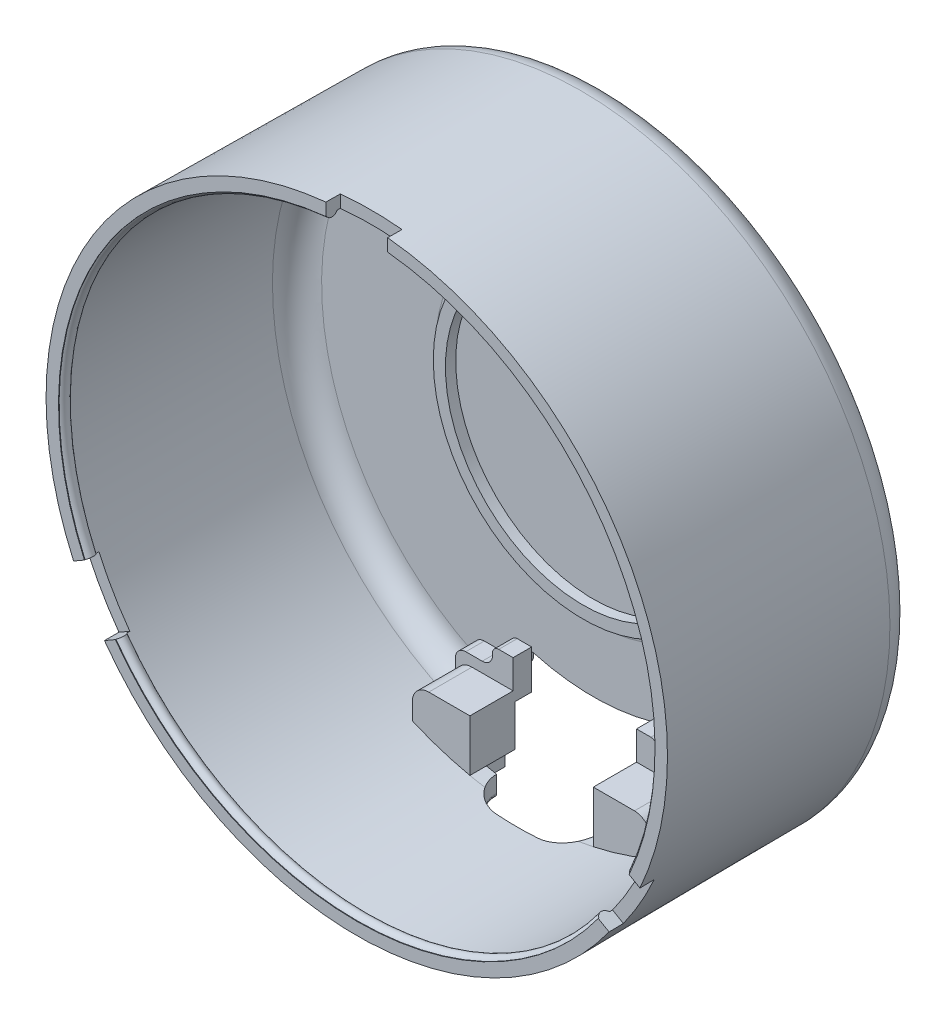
SolidWorks part; units mm, degrees
ref_plane "Plane1" through (0, 0, 0) normal (0, 0, 1) x (1, 0, 0)
ref_plane "Plane2" through (0, 0, 0) normal (0, 1, 0) x (1, 0, 0)
ref_plane "Plane3" through (0, 0, 0) normal (1, 0, 0) x (0, 0, -1)
sketch "Sketch1" plane through (0, 0, 0) normal (0, 0, 1) x (1, 0, 0)
  circle A0 centre (0, 0) radius 19.05
  dimension "D1" = 38.1
extrude "Base-Extrude" add sketch "Sketch1" along normal blind 15.367 draft 0.5
ref_plane "Plane4" through (0, 0, 6.604) normal (0, 0, -1) x (-1, 0, 0)
sketch "Sketch9" plane through (0, 0, 6.604) normal (0, 0, -1) x (-1, 0, 0)
  line L0 (6.604, -18.5442) -> (6.604, -12.598)
  line L1 (-6.604, -12.598) -> (-6.604, -18.5442)
  arc A0 (-6.604, -18.5442) -> (6.604, -18.5442) centre (0, 0) ccw
  arc A1 (-6.604, -12.598) -> (6.604, -12.598) centre (0, 0) ccw
  dimension "D1" = 39.37
  dimension "D4" = 28.448
  dimension "D2" = 13.208
  dimension "D3" = 6.604
extrude "Boss-Extrude1" add sketch "Sketch9" along normal up to surface (6.604 mm away)
sketch "Sketch6" plane through (0, 0, 0) normal (0, 1, 0) x (1, 0, 0)
  line L0 (-18.415, -15.367) -> (-18.3007, -2.2727)
  line L1 (19.05, 0) -> (-19.05, 0) construction
  line L2 (-19.1841, -15.367) -> (19.1841, -15.367) construction
  line L3 (-16.7768, -0.762) -> (0, -0.762)
  line L4 (0, -15.367) -> (0, 0) construction
  line L5 (-18.415, -15.367) -> (0, -15.367)
  line L6 (0, -0.762) -> (0, -15.367)
  line L10 (0, -0.762) -> (0, -20.5549) construction
  arc A0 (-18.3007, -2.2727) -> (-16.7768, -0.762) centre (-16.7768, -2.286) cw
  dimension "D3" = 1.524
  dimension "D1" = 90.5
  dimension "D2" = 18.415
  dimension "D4" = 0.762
revolve "Cut-Revolve1" cut sketch "Sketch6" angle 360 about L10
sketch "Sketch3" plane through (0, 0, 0) normal (0, 1, 0) x (1, 0, 0)
  line L1 (18.4147, -15.3293) -> (18.4089, -14.6709)
  line L2 (18.415, -15.367) -> (18.3007, -2.2727) construction
  line L4 (0, 0) -> (0, -15.7183) construction
  line L5 (0, -15.367) -> (0, 0) construction
  line L6 (-19.1841, -15.367) -> (19.1841, -15.367) construction
  arc A0 (18.4089, -14.6709) -> (18.4147, -15.3293) centre (18.5769, -14.9987) ccw
  dimension "D1" = 0.3683
  dimension "D3" = 0.6584
  dimension "D2" = 0.2032
revolve "Boss-Revolve1" add sketch "Sketch3" angle 360 about L4
sketch "Sketch18" plane through (0, 0, 0) normal (0, 0, -1) x (-1, 0, 0)
  line L0 (-7.366, -17.1725) -> (-7.366, -12.954)
  line L1 (7.366, -17.1725) -> (7.366, -12.954)
  line L2 (6.604, -17.8687) -> (6.604, -18.5442) construction
  line L3 (-6.604, -18.5442) -> (-6.604, -17.8687) construction
  line L4 (7.366, -12.954) -> (-7.366, -12.954)
  arc A2 (-7.366, -17.1725) -> (7.366, -17.1725) centre (0, 0) ccw
  dimension "D1" = 12.954
  dimension "D4" = 37.3712
  dimension "D2" = 0.762
  dimension "D3" = 0.762
extrude "Boss-Extrude2" add sketch "Sketch18" against normal blind 4.572
sketch "Sketch4" plane through (0, 0, 0) normal (0, 1, 0) x (1, 0, 0)
  line L0 (-3.175, -3.556) -> (3.175, -3.556) construction
  line L1 (1.27, -5.461) -> (-1.27, -5.461)
  line L2 (19.05, 0) -> (-19.05, 0) construction
  line L3 (0, 0) -> (0, -1.143) construction
  line L5 (3.175, -0.762) -> (-3.175, -0.762)
  line L6 (3.175, -3.556) -> (3.175, -0.762)
  line L8 (-3.175, -3.556) -> (-3.175, -0.762)
  arc A0 (1.27, -5.461) -> (3.175, -3.556) centre (1.27, -3.556) ccw
  arc A1 (-3.175, -3.556) -> (-1.27, -5.461) centre (-1.27, -3.556) ccw
  dimension "D1" = 3.81
  dimension "D2" = 2.54
  dimension "D3" = 1.27
  dimension "D4" = 3.556
  dimension "D5" = 0.762
extrude "Cut-Extrude7" cut sketch "Sketch4" against normal through all
sketch "Sketch10" plane through (0, 0, 0) normal (0, 0, -1) x (-1, 0, 0)
  line L0 (6.604, -15.367) -> (6.604, -18.5442)
  line L1 (-6.604, -18.5442) -> (-6.604, -15.367)
  line L2 (-6.604, -18.5442) -> (-6.604, -17.8687) construction
  line L3 (6.604, -17.8687) -> (6.604, -18.5442) construction
  line L4 (-3.0988, -13.3614) -> (-3.0988, -15.367)
  line L5 (-3.0988, -15.367) -> (-6.604, -15.367)
  line L6 (3.0988, -13.3614) -> (3.0988, -15.367)
  line L7 (3.0988, -15.367) -> (6.604, -15.367)
  arc A0 (-6.604, -18.5442) -> (6.604, -18.5442) centre (0, 0) ccw
  arc A1 (-3.0988, -13.3614) -> (3.0988, -13.3614) centre (0, 0) ccw
  arc A2 (-6.604, -18.5442) -> (6.604, -18.5442) centre (0, 0) ccw construction
  dimension "D1" = 27.432
  dimension "D2" = 6.1976
  dimension "D3" = 15.367
  dimension "D4" = 3.0988
extrude "Cut-Extrude9" cut sketch "Sketch10" against normal blind 1.778
fillet "Fillet7" radius 1.524 1 edges at (0, 19.05, 0)
sketch "Sketch20" plane through (0, 0, 1.778) normal (0, 0, -1) x (-1, 0, 0)
  line L0 (-5.08, -16.51) -> (5.08, -16.51) construction
  circle A0 centre (-5.08, -16.51) radius 0.6604
  circle A1 centre (5.08, -16.51) radius 0.6604
  dimension "D1" = 10.16
  dimension "D4" = 1.3208
  dimension "D2" = 16.51
  dimension "D3" = 5.08
extrude "Cut-Extrude11" cut sketch "Sketch20" against normal blind 2.286
sketch "Sketch21" plane through (0, 0, 1.778) normal (0, 0, -1) x (-1, 0, 0)
  line L2 (-4.445, -17.7734) -> (-4.445, -19.1766)
  line L4 (4.445, -17.7734) -> (4.445, -19.1766)
  arc A0 (-4.445, -19.1766) -> (4.445, -19.1766) centre (0, 0) ccw
  arc A2 (-4.445, -17.7734) -> (4.445, -17.7734) centre (0, 0) ccw
  arc A3 (2.8814, -18.0928) -> (7.366, -16.7748) centre (0, 0) ccw construction
  arc A4 (-6.604, -18.5442) -> (-3.175, -19.4273) centre (0, 0) ccw construction
  dimension "D1" = 4.445
  dimension "D2" = 8.89
extrude "Cut-Extrude12" cut sketch "Sketch21" against normal blind 1.778
sketch "Sketch23" plane through (0, 0, 4.572) normal (0, 0, 1) x (1, 0, 0)
  line L0 (7.366, -12.954) -> (7.366, -14.732)
  line L1 (-7.366, -12.954) -> (-7.366, -14.732)
  line L2 (-7.366, -14.732) -> (7.366, -14.732)
  line L3 (-7.366, -16.7748) -> (-7.366, -12.954) construction
  line L4 (7.366, -12.954) -> (7.366, -16.7748) construction
  line L5 (-7.366, -12.954) -> (7.366, -12.954)
  line L6 (-6.604, -15.367) -> (-3.175, -15.367) construction
  line L7 (-7.366, -12.954) -> (-2.8814, -12.954) construction
  dimension "D1" = 0.635
extrude "Cut-Extrude13" cut sketch "Sketch23" against normal blind 2.667
sketch "Sketch24" plane through (0, 0, 0) normal (0, 0, -1) x (-1, 0, 0)
  line L0 (-4.445, -12.9758) -> (-4.445, -14.732)
  line L1 (-4.445, -14.732) -> (-6.604, -14.732)
  line L2 (-6.604, -14.732) -> (-6.604, -15.367)
  line L3 (4.445, -12.9758) -> (4.445, -14.732)
  line L4 (4.445, -14.732) -> (6.604, -14.732)
  line L5 (6.604, -14.732) -> (6.604, -15.367)
  line L7 (3.0988, -13.3614) -> (3.0988, -15.367)
  line L8 (3.0988, -15.367) -> (6.604, -15.367)
  line L9 (-3.0988, -15.367) -> (-6.604, -15.367)
  line L10 (-3.0988, -13.3614) -> (-3.0988, -15.367)
  arc A0 (-4.445, -12.9758) -> (-3.0988, -13.3614) centre (0, 0) ccw
  arc A1 (-3.0988, -13.3614) -> (3.0988, -13.3614) centre (0, 0) ccw construction
  arc A2 (3.0988, -13.3614) -> (4.445, -12.9758) centre (0, 0) ccw
  dimension "D1" = 8.89
  dimension "D2" = 4.445
  dimension "D3" = 14.732
extrude "Cut-Extrude14" cut sketch "Sketch24" against normal blind 0.762
fillet "Fillet9" radius 1.016 2 edges at (7.366, -14.732, 3.2385) (-7.366, -14.732, 3.2385)
sketch "Sketch25"
  line L0 (7.366, -12.954) -> (3.175, -12.954) construction
  line L1 (-7.366, -12.954) -> (-5.08, -12.954)
  line L2 (-7.366, -12.954) -> (-7.366, -14.097)
  line L3 (-7.366, -14.097) -> (-5.08, -14.097)
  line L4 (-5.08, -12.954) -> (-5.08, -14.097)
  line L5 (5.08, -12.954) -> (7.366, -12.954)
  line L6 (5.08, -12.954) -> (5.08, -14.097)
  line L7 (5.08, -14.097) -> (7.366, -14.097)
  line L8 (7.366, -12.954) -> (7.366, -14.097)
  line L9 (7.366, -15.748) -> (7.366, -12.954) construction
  line L10 (-4.445, -14.732) -> (-4.445, -12.9758) construction
  line L11 (-6.35, -14.732) -> (-2.8814, -14.732) construction
  line L12 (4.445, -12.9758) -> (4.445, -14.732) construction
fillet "Fillet10" radius 0.635 6 edges at (-4.445, -12.9758, 0.381) (-4.445, -14.732, 0.381) (-6.604, -14.732, 0.381) (4.445, -12.9758, 0.381) (6.604, -14.732, 0.381) (4.445, -14.732, 0.381)
extrude "Cut-Extrude15" cut sketch "Sketch25" along normal up to surface (1.143 mm away)
fillet "Fillet11" radius 0.635 4 edges at (-5.08, -14.097, 1.3335) (-7.366, -14.097, 1.3335) (7.366, -14.097, 1.3335) (5.08, -14.097, 1.3335)
fillet "Fillet12" radius 0.381 2 edges at (-5.08, -12.954, 1.3335) (5.08, -12.954, 1.3335)
sketch "Sketch27" plane through (0, 0, 4.572) normal (0, 0, 1) x (1, 0, 0)
  line L2 (3.81, -17.9203) -> (3.81, -12.954)
  line L4 (-3.81, -17.9203) -> (-3.81, -12.954)
  line L5 (-3.81, -12.954) -> (3.81, -12.954)
  line L6 (-3.175, -12.954) -> (-4.699, -12.954) construction
  arc A0 (-3.81, -17.9203) -> (3.81, -17.9203) centre (0, 0) ccw
  arc A1 (2.8814, -18.0928) -> (7.366, -16.7748) centre (0, 0) ccw construction
  dimension "D1" = 7.62
  dimension "D2" = 3.81
extrude "Cut-Extrude17" cut sketch "Sketch27" against normal up to surface (3.81 mm away)
fillet "Fillet14" radius 0.3048 3 edges at (0, -19.685, 5.461) (2.461, -19.5306, 5.0428) (-2.7655, -19.4898, 4.7361)
sketch "Sketch28" plane through (0, 0, 15.367) normal (0, 0, 1) x (1, 0, 0)
  line L1 (-1.905, 22.2403) -> (1.905, 22.2403)
  line L2 (-1.905, 22.2403) -> (-1.905, 0)
  line L3 (-1.905, 0) -> (1.905, 0)
  line L4 (1.905, 22.2403) -> (1.905, 0)
  dimension "D1" = 3.81
  dimension "D2" = 22.2403
extrude "Cut-Extrude18" cut sketch "Sketch28" against normal blind 0.889
pattern_circular "CirPattern1" count 3 over 360 about axis through (0, 0, 0) along (0, 0, 1) of "Cut-Extrude18"
sketch "Sketch29" plane through (0, 0, 0.762) normal (0, 0, 1) x (1, 0, 0)
  circle A0 centre (0, 0) radius 9.2456
  circle A1 centre (0, 0) radius 8.4963
  dimension "D1" = 16.9926
  dimension "D2" = 18.4912
extrude "Boss-Extrude3" add sketch "Sketch29" along normal blind 0.635
fillet "Fillet15" radius 0.508 1 edges at (-9.2456, 0, 0.762)
fillet "Fillet17" radius 1.905 3 edges at (6.604, -18.2371, 6.604) (-6.604, -18.2371, 6.604)
fillet "Fillet18" radius 0.508 5 edges at (0, -19.685, 6.604) (-5.9212, -18.7734, 6.1603) (6.2236, -18.6753, 5.8413) (-6.604, -18.5442, 3.2385) (6.604, -18.5442, 3.2385)
